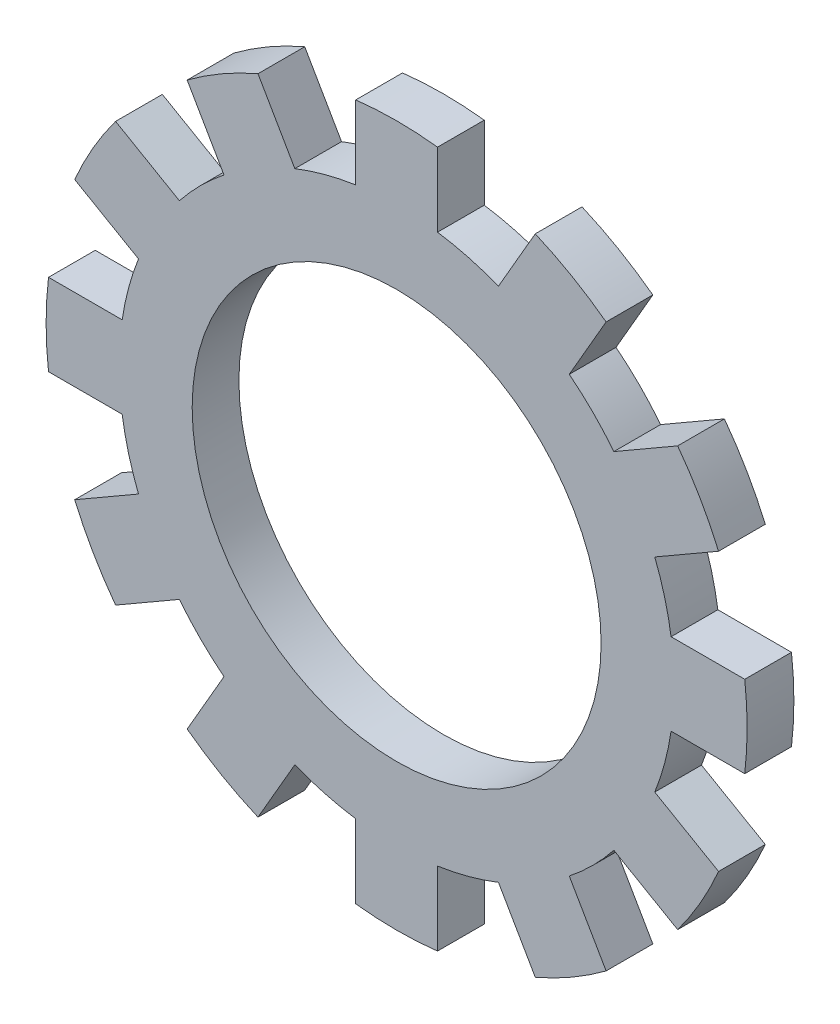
SolidWorks part; units mm, degrees
ref_plane "Front Plane" through (0, 0, 0) normal (0, 0, 1) x (1, 0, 0)
ref_plane "Top Plane" through (0, 0, 0) normal (0, 1, 0) x (1, 0, 0)
ref_plane "Right Plane" through (0, 0, 0) normal (1, 0, 0) x (0, 0, -1)
sketch "Sketch1" plane through (0, 0, 0) normal (0, 0, 1) x (1, 0, 0)
  circle A0 centre (0, 0) radius 1.75
  circle A1 centre (0, 0) radius 2.375
  dimension "D1" = 3.5
  dimension "D2" = 4.75
extrude "Boss-Extrude1" add sketch "Sketch1" along normal mid plane 0.4
sketch "Sketch2" plane through (0, 0, 0) normal (0, 0, 1) x (1, 0, 0)
  line L0 (0, 2.6811) -> (0, -2.8425) construction
sketch "Sketch3" plane through (0, 0, 0) normal (0, 0, 1) x (1, 0, 0)
  line L0 (-0.35, 2.9795) -> (-0.35, 2.3491)
  line L2 (0, 2.6811) -> (0, -2.8425) construction
  line L3 (0, 2.375) -> (0, 3)
  arc A0 (0, 3) -> (-0.35, 2.9795) centre (0, 0) ccw
  arc A1 (0, 2.375) -> (-0.35, 2.3491) centre (0, 0) ccw
  circle A2 centre (0, 0) radius 2.375 construction
  dimension "D2" = 3
  dimension "D1" = 0.35
extrude "Boss-Extrude2" add sketch "Sketch3" along normal mid plane 0.4
mirror "Mirror1" about plane through (0, 0, 0) normal (1, 0, 0) of "Boss-Extrude2"
pattern_circular "CirPattern2" count 12 over 360 about axis through (0, 0, 0) along (0, 0, 1) of "Boss-Extrude2", "Mirror1"
